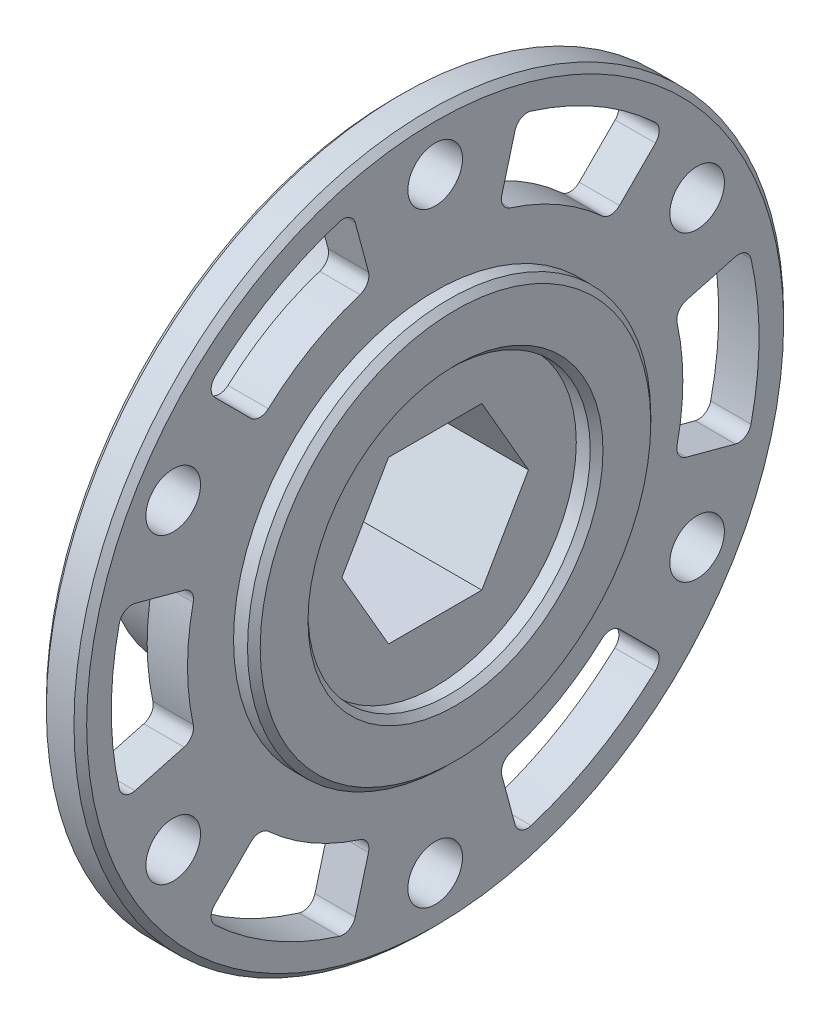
SolidWorks part; units mm, degrees
ref_plane "Front Plane" through (0, 0, 0) normal (0, 0, 1) x (1, 0, 0)
ref_plane "Top Plane" through (0, 0, 0) normal (0, 1, 0) x (1, 0, 0)
ref_plane "Right Plane" through (0, 0, 0) normal (1, 0, 0) x (0, 0, -1)
ref_plane "Plane1" through (0, 0, 0) normal (0, 0, -1) x (-1, 0, 0)
sketch "Sketch1" plane through (0, 0, 0) normal (0, 0, -1) x (-1, 0, 0)
  line L0 (-12.7, 27.94) -> (-12.7, 0)
  line L1 (-12.7, 0) -> (-9.525, 0)
  line L2 (-9.525, 0) -> (-9.525, 27.94)
  line L3 (-9.525, 27.94) -> (-12.7, 27.94)
  line L4 (-12.7, 0) -> (-9.525, 0) construction
revolve "Revolve1" add sketch "Sketch1" angle 360 about L4
sketch "Sketch2" plane through (12.7, 0, 0) normal (1, 0, 0) x (0, 0, -1)
  circle A0 centre (0, 0) radius 15.875
extrude "Boss-Extrude1" add sketch "Sketch2" along normal blind 1.6002
sketch "Sketch3" plane through (9.525, 0, 0) normal (-1, 0, 0) x (0, 0, 1)
  circle A0 centre (0, 0) radius 14.295
extrude "Boss-Extrude2" add sketch "Sketch3" along normal blind 9.525
sketch "Sketch4" plane through (0, 0, 0) normal (-1, 0, 0) x (0, 0, 1)
  line L0 (3.6735, 6.3627) -> (-3.6735, 6.3627)
  line L1 (-3.6735, 6.3627) -> (-7.347, 0)
  line L2 (-7.347, 0) -> (-3.6735, -6.3627)
  line L3 (-3.6735, -6.3627) -> (3.6735, -6.3627)
  line L4 (3.6735, -6.3627) -> (7.347, 0)
  line L5 (7.347, 0) -> (3.6735, 6.3627)
extrude "Cut-Extrude1" cut sketch "Sketch4" against normal through all
sketch "Sketch5" plane through (12.7, 0, 0) normal (1, 0, 0) x (0, 0, -1)
  line L0 (-24.6181, -6.6482) -> (-18.8226, -5.0953)
  line L1 (-18.8226, 5.0953) -> (-24.6181, 6.6482)
  arc A0 (-18.8226, -5.0953) -> (-18.8226, 5.0953) centre (0, 0) cw
  arc A1 (-24.6181, 6.6482) -> (-24.6181, -6.6482) centre (0, 0) ccw
extrude "Cut-Extrude2" cut sketch "Sketch5" against normal through all
sketch "Sketch6" plane through (12.7, 0, 0) normal (1, 0, 0) x (0, 0, -1)
  line L0 (-18.0665, 17.9958) -> (-13.8239, 13.7532)
  line L1 (-4.9987, 18.8484) -> (-6.5516, 24.644)
  arc A0 (-13.8239, 13.7532) -> (-4.9987, 18.8484) centre (0, 0) cw
  arc A1 (-6.5516, 24.644) -> (-18.0665, 17.9958) centre (0, 0) ccw
extrude "Cut-Extrude3" cut sketch "Sketch6" against normal through all
sketch "Sketch7" plane through (12.7, 0, 0) normal (1, 0, 0) x (0, 0, -1)
  line L0 (6.5516, 24.644) -> (4.9987, 18.8484)
  line L1 (13.8239, 13.7532) -> (18.0665, 17.9958)
  arc A0 (4.9987, 18.8484) -> (13.8239, 13.7532) centre (0, 0) cw
  arc A1 (18.0665, 17.9958) -> (6.5516, 24.644) centre (0, 0) ccw
extrude "Cut-Extrude4" cut sketch "Sketch7" against normal through all
sketch "Sketch8" plane through (12.7, 0, 0) normal (1, 0, 0) x (0, 0, -1)
  line L0 (24.6181, 6.6482) -> (18.8226, 5.0953)
  line L1 (18.8226, -5.0953) -> (24.6181, -6.6482)
  arc A0 (18.8226, 5.0953) -> (18.8226, -5.0953) centre (0, 0) cw
  arc A1 (24.6181, -6.6482) -> (24.6181, 6.6482) centre (0, 0) ccw
extrude "Cut-Extrude5" cut sketch "Sketch8" against normal through all
sketch "Sketch9" plane through (12.7, 0, 0) normal (1, 0, 0) x (0, 0, -1)
  line L0 (18.0665, -17.9958) -> (13.8239, -13.7532)
  line L1 (4.9987, -18.8484) -> (6.5516, -24.644)
  arc A0 (13.8239, -13.7532) -> (4.9987, -18.8484) centre (0, 0) cw
  arc A1 (6.5516, -24.644) -> (18.0665, -17.9958) centre (0, 0) ccw
extrude "Cut-Extrude6" cut sketch "Sketch9" against normal through all
sketch "Sketch10" plane through (9.525, 0, 0) normal (-1, 0, 0) x (0, 0, 1)
  line L0 (18.0665, -17.9958) -> (13.8239, -13.7532)
  line L1 (4.9987, -18.8484) -> (6.5516, -24.644)
  arc A0 (6.5516, -24.644) -> (18.0665, -17.9958) centre (0, 0) ccw
  arc A1 (13.8239, -13.7532) -> (4.9987, -18.8484) centre (0, 0) cw
extrude "Cut-Extrude7" cut sketch "Sketch10" against normal through all
sketch "Sketch11" plane through (0, 0, 0) normal (0, 1, 0) x (1, 0, 0)
  line L0 (12.7, 11.1125) -> (12.7, 0)
  line L1 (12.7, 0) -> (14.3002, 0)
  line L2 (14.3002, 0) -> (14.3002, 11.1125)
  line L3 (14.3002, 11.1125) -> (12.7, 11.1125)
  line L4 (12.7, 0) -> (14.3002, 0) construction
revolve "Cut-Revolve1" cut sketch "Sketch11" angle 360 about L4
hole_wizard "Ø4.3 (4.3) Diameter Hole1" positions "Sketch13" profile "Sketch12" hole size "Ø4.3" standard "ANSI Metric"
sketch "Sketch13" plane through (9.525, 0, 0) normal (-1, 0, 0) x (0, 0, 1)
  point P0 (-20.6244, -11.9075)
  point P1 (-20.6244, 11.9075)
  point P2 (0, 23.815)
  point P3 (20.6244, 11.9075)
  point P4 (20.6244, -11.9075)
  point P5 (0, -23.815)
sketch "Sketch12" plane through (9.525, -11.9075, -20.6244) normal (0, 1, 0) x (0, 0, 1)
  line L0 (0, 0) -> (0, 4.7752)
  line L1 (0, 4.7752) -> (2.15, 4.7752)
  line L2 (2.15, 4.7752) -> (2.15, 0)
  line L5 (2.15, 0) -> (0, 0)
  line L11 (0, -6.35) -> (0, 107.95) construction
  dimension "Thru Hole Dia." = 4.3
  dimension "Thru Hole Depth" = 4.7752
chamfer "Chamfer1" distance 0.5 angle 45 4 edges at (14.3002, 0, -15.875) (14.3002, 0, -11.1125) (12.7, 0, 27.94) (9.525, 0, 27.94)
chamfer "Chamfer2" distance 1 angle 45 1 edges at (0, 0, 14.295)
fillet "Fillet1" radius 1 25 edges at (11.1125, 18.8484, -4.9987) (11.1125, 5.0953, 18.8226) (11.1125, 13.7532, 13.8239) (11.1125, -17.9958, 18.0665) (11.1125, 24.644, -6.5516) (11.1125, -24.644, 6.5516) (11.1125, 17.9958, 18.0665) (11.1125, -13.7532, 13.8239) (11.1125, -6.6482, 24.6181) (11.1125, -18.8484, 4.9987) (11.1125, 17.9958, -18.0665) (11.1125, -24.644, -6.5516) (11.1125, 13.7532, -13.8239) (11.1125, -17.9958, -18.0665) (11.1125, 24.644, 6.5516) (11.1125, -18.8484, -4.9987) (11.1125, 18.8484, 4.9987) (11.1125, -13.7532, -13.8239) (11.1125, 6.6482, 24.6181) (11.1125, -6.6482, -24.6181) (11.1125, -5.0953, 18.8226) (11.1125, -5.0953, -18.8226) (9.525, 0, 14.295) (11.1125, 5.0953, -18.8226) (11.1125, 6.6482, -24.6181)
